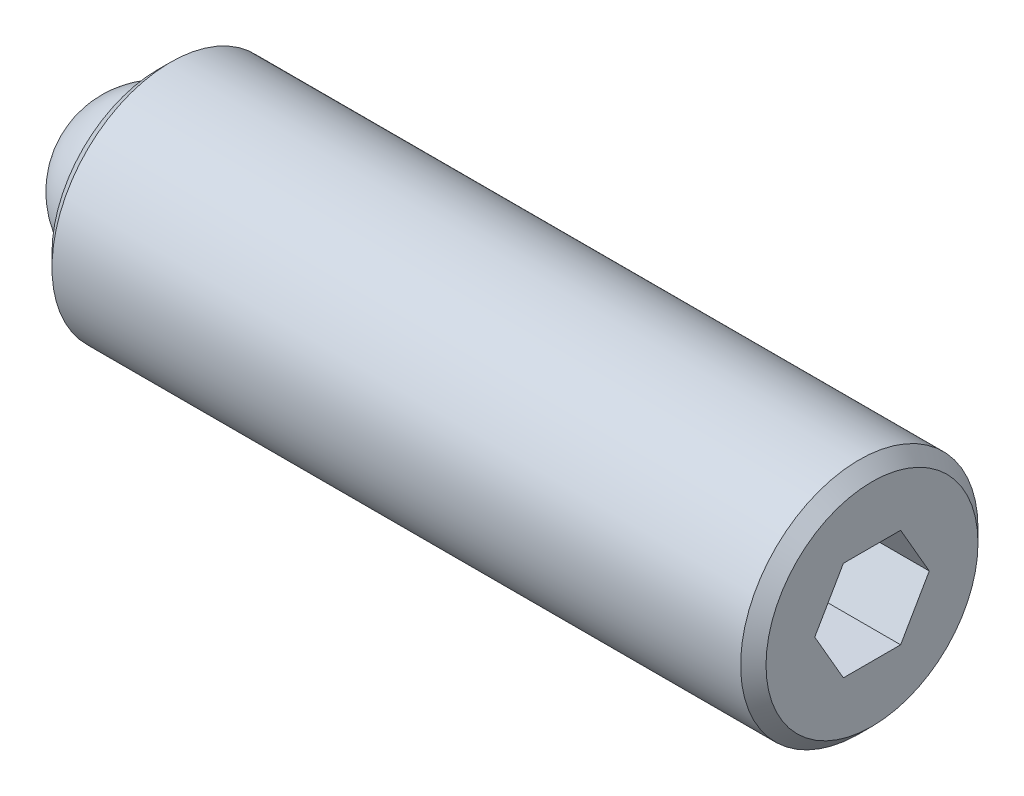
SolidWorks part; units mm, degrees
ref_plane "Front Plane" through (0, 0, 0) normal (0, 0, 1) x (1, 0, 0)
ref_plane "Top Plane" through (0, 0, 0) normal (0, 1, 0) x (1, 0, 0)
ref_plane "Right Plane" through (0, 0, 0) normal (1, 0, 0) x (0, 0, -1)
sketch "Sketch2" plane through (0, 0, 0) normal (1, 0, 0) x (0, 0, -1)
  circle A0 centre (0, 0) radius 2.3749
  dimension "D1" = 4.7498
extrude "Boss-Extrude1" add sketch "Sketch2" along normal blind 14.2875
sketch "Sketch3" plane through (0, 0, 0) normal (-1, 0, 0) x (0, 0, 1)
  circle A0 centre (0, 0) radius 1.5875
  dimension "D1" = 3.175
chamfer "Chamfer1" distance 0.254 angle 45 1 edges at (0, 0, -2.3749)
chamfer "Chamfer2" distance 0.254 angle 45 1 edges at (14.2875, 0, -2.3749)
sketch "Sketch4" plane through (14.2875, 0, 0) normal (1, 0, 0) x (0, 0, -1)
  line L1 (1.1457, 0) -> (0.5728, 0.9922)
  line L2 (0.5728, 0.9922) -> (-0.5728, 0.9922)
  line L3 (-0.5728, 0.9922) -> (-1.1457, 0)
  line L4 (-1.1457, 0) -> (-0.5728, -0.9922)
  line L5 (-0.5728, -0.9922) -> (0.5728, -0.9922)
  line L6 (0.5728, -0.9922) -> (1.1457, 0)
  circle A0 centre (0, 0) radius 0.9922 construction
extrude "Cut-Extrude2" cut sketch "Sketch4" against normal blind 2.286
extrude "Cut-Extrude3" cut sketch "Sketch3" against normal blind 1.5875
sketch "Sketch5" plane through (0, 0, 0) normal (-1, 0, 0) x (0, 0, 1)
  line L0 (0, 0) -> (0, -1.5875)
  line L1 (0, 0) -> (0, 1.5875)
  arc A0 (0, 1.5875) -> (0, -1.5875) centre (0, 0) ccw
revolve "Revolve1" add sketch "Sketch5" angle 360 about L1
